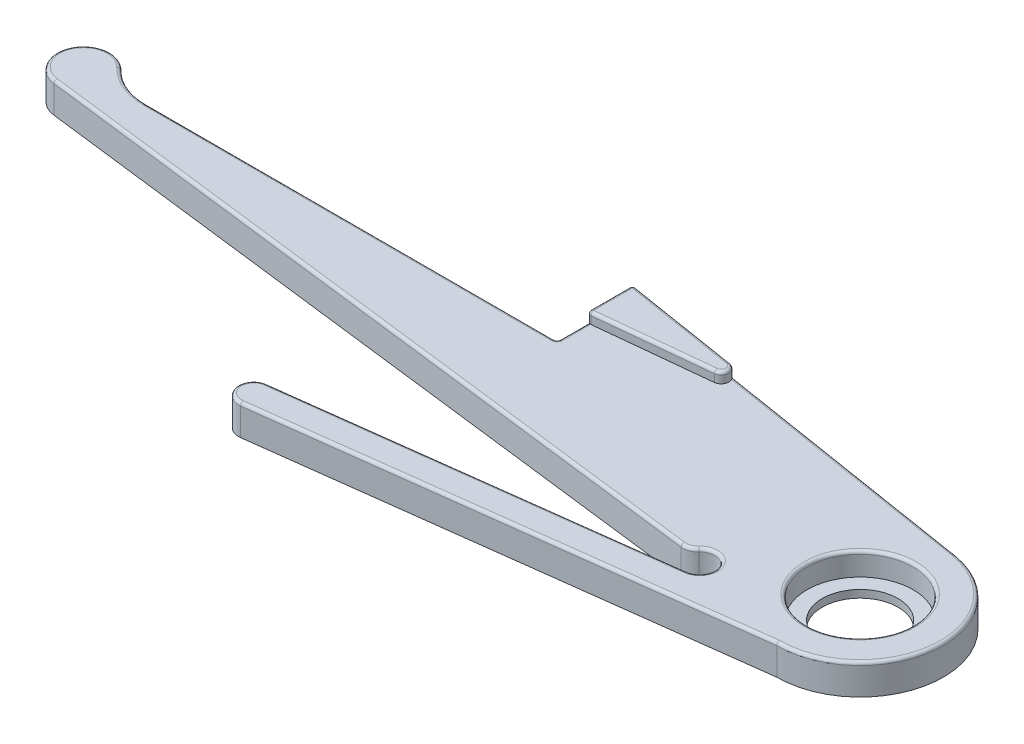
SolidWorks part; units mm, degrees
ref_plane "Front Plane" through (0, 0, 0) normal (0, 0, 1) x (1, 0, 0)
ref_plane "Top Plane" through (0, 0, 0) normal (0, 1, 0) x (1, 0, 0)
ref_plane "Right Plane" through (0, 0, 0) normal (1, 0, 0) x (0, 0, -1)
ref_plane "Plane1" through (0, 2, 0) normal (0, 1, 0) x (1, 0, 0)
sketch "Sketch1" plane through (0, 2, 0) normal (0, 1, 0) x (1, 0, 0)
  line L0 (0.871, 5.4306) -> (-24.5, 9.5)
  line L1 (-24.5, 9.5) -> (-24.5, 4.5)
  line L2 (-24.5, 4.5) -> (-54, 4.5)
  line L3 (-55.9633, 2.7676) -> (-8.7824, -3.0255)
  line L4 (-7.0674, -4.3846) -> (-31.6345, -7.5161)
  line L5 (-31.3816, -9.5) -> (0, -5.5)
  arc A0 (-54, 4.5) -> (-55.9633, 2.7676) centre (-55.75, 4.5045) ccw
  arc A1 (-8.7824, -3.0255) -> (-7.9271, -2.7128) centre (-8.6605, -2.033) ccw
  arc A2 (-7.9271, -2.7128) -> (-7.0674, -4.3846) centre (-7.1938, -3.3927) cw
  arc A3 (-31.6345, -7.5161) -> (-31.3816, -9.5) centre (-31.508, -8.508) ccw
  arc A4 (0, -5.5) -> (0.871, 5.4306) centre (0, 0) ccw
extrude "Boss-Extrude1" add sketch "Sketch1" against normal blind 2
sketch "Sketch2" plane through (0, 2, 0) normal (0, 1, 0) x (-1, 0, 0)
  line L0 (16.8934, -7.2844) -> (24.5, -6.5)
  line L1 (24.5, -6.5) -> (24.5, -9.5)
  line L2 (24.5, -9.5) -> (16.8655, -8.2755)
  arc A0 (16.8655, -8.2755) -> (16.8934, -7.2844) centre (16.9447, -7.7818) cw
extrude "Boss-Extrude2" add sketch "Sketch2" along normal blind 0.7
hole_wizard "M7x1.0 Tapped Hole1" positions "Sketch4" profile "Sketch3" tap size "M7x1.0" standard "ANSI Metric"
sketch "Sketch4" plane through (0, 2, 0) normal (0, 1, 0) x (1, 0, 0)
  point P0 (0, 0)
sketch "Sketch3" plane through (0, 2, 0) normal (1, 0, 0) x (0, 0, 1)
  line L0 (0, 0) -> (0, 2)
  line L1 (0, 2) -> (2.5, 2)
  line L3 (2.5, 2) -> (2.5, 1.5)
  line L4 (2.5, 1.5) -> (3.5, 1.5)
  line L5 (3.5, 1.5) -> (3.5, 0)
  line L7 (3.5, 0) -> (0, 0)
  line L11 (0, -6.35) -> (0, 107.95) construction
  dimension "Thru Tap Drill Dia." = 5
  dimension "Thru Tap Drill Depth" = 2
  dimension "Thread Major Dia." = 7
  dimension "Thread Depth" = 1.5
fillet "Fillet1" radius 4 1 edges at (-54, 1, -4.5)
fillet "Fillet2" radius 0.2 20 edges at (-24.5, 1.35, -9.5) (-24.5, 2.7, -8) (-20.6967, 2.7, -6.8922) (-20.6827, 2.7, -8.8877) (-16.4449, 2.7, -7.7677) (5.4826, 2, 0.4369) (-7.9972, 2, -6.853) (-24.5, 2.35, -6.5) (-15.6908, 2, 7.5) (-32.5, 2, 8.6345) (-19.3509, 2, 5.9503) (-6.3045, 2, 2.9353) (-8.3171, 2, 2.9722) (-32.3728, 2, 0.129) (-57.3162, 2, -5.2851) (-53.1773, 2, -4.8178) (-38.0575, 2, -4.5) (-24.5, 2, -5.5) (-24.5, 1, -4.5) (0, 2, 3.5)
